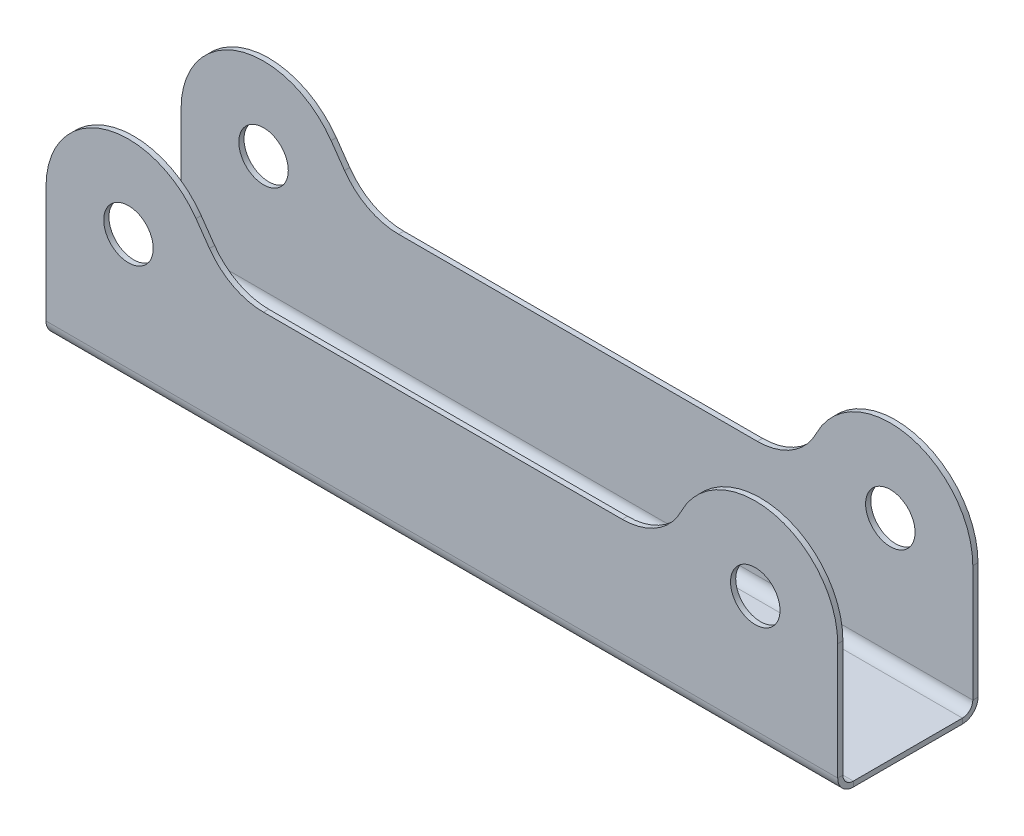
SolidWorks part; units mm, degrees
ref_plane "Front" through (0, 0, 0) normal (0, 0, 1) x (1, 0, 0)
ref_plane "Top" through (0, 0, 0) normal (0, 1, 0) x (1, 0, 0)
ref_plane "Right" through (0, 0, 0) normal (1, 0, 0) x (0, 0, -1)
sketch "Sketch1" plane through (0, 0, 0) normal (0, 0, 1) x (1, 0, 0)
  line L0 (-15.875, 0) -> (-15.875, -25.4)
  line L1 (-15.875, -25.4) -> (136.525, -25.4)
  line L2 (136.525, -25.4) -> (136.525, 0)
  line L3 (105.7324, 5.4296) -> (103.7562, 0)
  line L4 (103.7562, 0) -> (19.3798, 0)
  line L5 (13.004, 9.1055) -> (19.3798, 0)
  line L6 (0, 0) -> (120.65, 0) construction
  arc A0 (136.525, 0) -> (105.7324, 5.4296) centre (120.65, 0) ccw
  arc A1 (-15.875, 0) -> (13.004, 9.1055) centre (0, 0) cw
  dimension "D1" = 15.875
  dimension "D2" = 25.4
  dimension "D3" = 152.4
  dimension "D5" = 125
  dimension "D6" = 110
extrude "Base-Extrude" add sketch "Sketch1" along normal mid plane 27
fillet "Fillet1" radius 12.7 5 edges at (104.7443, 2.7148, 13.5) (105.7324, 5.4296, 0) (103.7562, 0, 0) (19.3798, 0, 0) (104.7443, 2.7148, -13.5)
shell "Shell1" thickness 1
sketch "Sketch2" plane through (0, 0, 13.5) normal (0, 0, 1) x (1, 0, 0)
  circle A0 centre (120.65, 0) radius 4.7625
  circle A1 centre (0, 0) radius 4.7625
  dimension "D1" = 9.525
extrude "Cut-Extrude1" cut sketch "Sketch2" against normal through all
sheet metal parameters "Sheet-Metal1" thickness 1 parameters "D1"=2
bend "SharpBend2" parameters "D1"=0, "D2"=1
flatten bends "Flatten-Bends1" parameters "D1"=0
sketch "Sharp-Sketch1" plane through (0, -24.4, 0) normal (0, 1, 0) x (-1, 0, 0)
  line L0 (15.875, 12.4635) -> (-136.525, 12.4635) construction
  line L1 (-136.525, -12.4635) -> (15.875, -12.4635) construction
bend "SharpBend1" parameters "D1"=0, "D2"=2
process bends "Process-Bends1" parameters "D1"=0
sketch "Flat-Sketch1" plane through (0, -24.4, 0) normal (0, 1, 0) x (-1, 0, 0)
